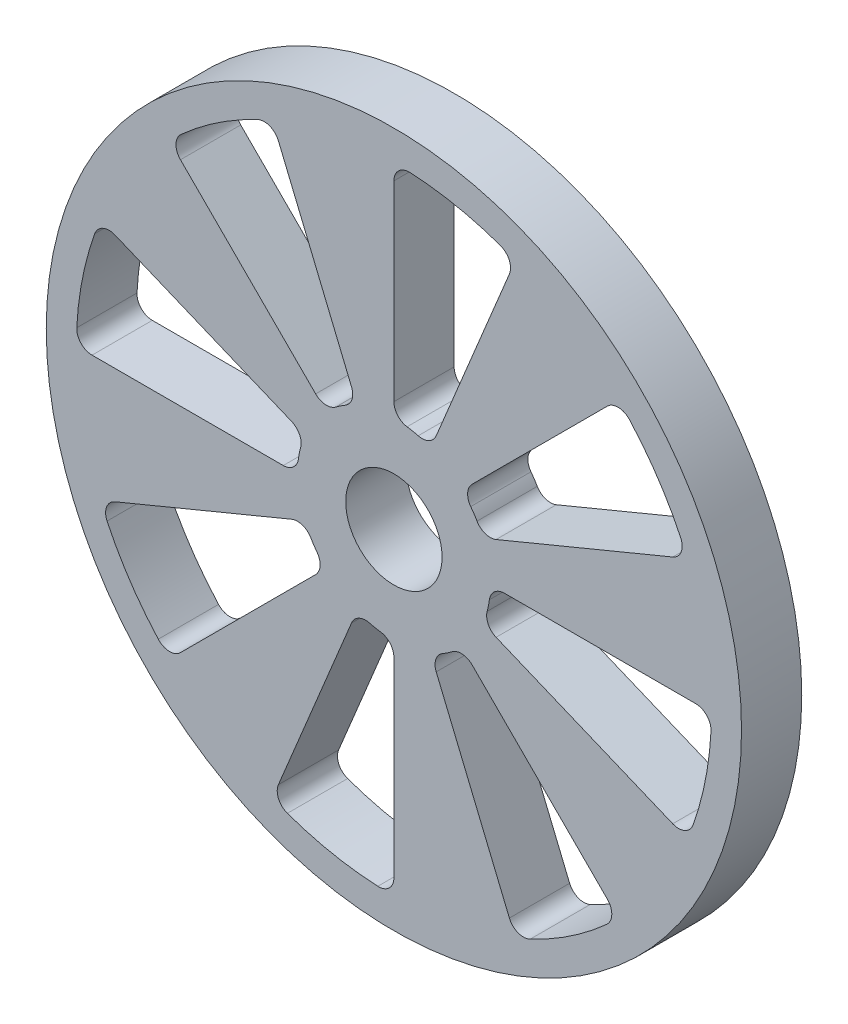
SolidWorks part; units mm, degrees
ref_plane "Front Plane" through (0, 0, 0) normal (0, 0, 1) x (1, 0, 0)
ref_plane "Top Plane" through (0, 0, 0) normal (0, 1, 0) x (1, 0, 0)
ref_plane "Right Plane" through (0, 0, 0) normal (1, 0, 0) x (0, 0, -1)
sketch "Sketch1" plane through (0, 0, 0) normal (0, 0, 1) x (1, 0, 0)
  line L0 (0, 8) -> (0, 26.355)
  line L1 (3.0615, 7.391) -> (10.0856, 24.3488)
  line L2 (5.6569, 5.6569) -> (18.6358, 18.6358)
  line L3 (7.391, 3.0615) -> (24.3488, 10.0856)
  line L4 (8, 0) -> (26.355, 0)
  line L5 (7.391, -3.0615) -> (24.3488, -10.0856)
  line L6 (5.6569, -5.6569) -> (18.6358, -18.6358)
  line L7 (3.0615, -7.391) -> (10.0856, -24.3488)
  line L8 (0, -8) -> (0, -26.355)
  line L9 (-3.0615, -7.391) -> (-10.0856, -24.3488)
  line L10 (-5.6569, -5.6569) -> (-18.6358, -18.6358)
  line L11 (-7.391, -3.0615) -> (-24.3488, -10.0856)
  line L12 (-8, 0) -> (-26.355, 0)
  line L13 (-7.391, 3.0615) -> (-24.3488, 10.0856)
  line L14 (-5.6569, 5.6569) -> (-18.6358, 18.6358)
  line L15 (-3.0615, 7.391) -> (-10.0856, 24.3488)
  circle A0 centre (0, 0) radius 28.855
  circle A1 centre (0, 0) radius 26.355
  circle A2 centre (0, 0) radius 8
  circle A3 centre (0, 0) radius 4
  point P41 (0, 0)
  dimension "D1" = 57.71
  dimension "D2" = 52.71
  dimension "D3" = 16
  dimension "D4" = 8
  dimension "D5" = 16
extrude "Boss-Extrude1" add sketch "Sketch1" along normal blind 5 contours A0 A1 | A2 L0 A1 L15 | A2 L2 A1 L1 | A2 L4 A1 L3 | A2 L6 A1 L5 | A2 L8 A1 L7 | A2 L10 A1 L9 | A2 L12 A1 L11 | A2 L14 A1 L13 | A2 A3
fillet "Fillet2" radius 1.27 32 edges at (-3.0615, 7.391, 2.5) (-7.391, -3.0615, 2.5) (-7.391, 3.0615, 2.5) (-5.6569, -5.6569, 2.5) (0, -8, 2.5) (-3.0615, -7.391, 2.5) (5.6569, 5.6569, 2.5) (7.391, -3.0615, 2.5) (3.0615, -7.391, 2.5) (5.6569, -5.6569, 2.5) (18.6358, -18.6358, 2.5) (26.355, 0, 2.5) (0, 8, 2.5) (8, 0, 2.5) (10.0856, -24.3488, 2.5) (-10.0856, -24.3488, 2.5) (-26.355, 0, 2.5) (-18.6358, 18.6358, 2.5) (0, 26.355, 2.5) (18.6358, 18.6358, 2.5) (7.391, 3.0615, 2.5) (3.0615, 7.391, 2.5) (-5.6569, 5.6569, 2.5) (-8, 0, 2.5) (-18.6358, -18.6358, 2.5) (0, -26.355, 2.5) (24.3488, -10.0856, 2.5) (24.3488, 10.0856, 2.5) (10.0856, 24.3488, 2.5) (-10.0856, 24.3488, 2.5) (-24.3488, 10.0856, 2.5) (-24.3488, -10.0856, 2.5)
